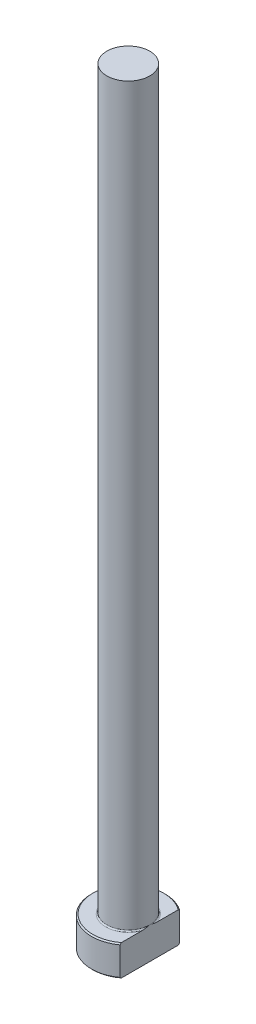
SolidWorks part; units mm, degrees
ref_plane "Front Plane" through (0, 0, 0) normal (0, 0, 1) x (1, 0, 0)
ref_plane "Top Plane" through (0, 0, 0) normal (0, 1, 0) x (1, 0, 0)
ref_plane "Right Plane" through (0, 0, 0) normal (1, 0, 0) x (0, 0, -1)
sketch "Sketch1" plane through (0, 0, 0) normal (0, 0, 1) x (1, 0, 0)
  line L0 (0, 259.9588) -> (0, -15.1925) construction
  line L1 (0, 0) -> (-6, 0)
  line L2 (-6, 0) -> (-6, 5)
  line L3 (-6, 5) -> (-3.5, 5)
  line L4 (-3.5, 5) -> (-3.5, 125)
  line L5 (-3.5, 125) -> (0, 125)
  line L6 (0, 125) -> (0, 0)
  dimension "L" = 125
  dimension "H" = 12
  dimension "T" = 5
  dimension "D" = 7
revolve "Revolve1" add sketch "Sketch1" angle 360 about L0
chamfer "Chamfer1" distance 0.2 angle 45 2 edges at (0, 5, 6) (0, 0, 6)
fillet "Fillet1" radius 0.2 1 edges at (0, 5, 3.5)
sketch "Sketch2" plane through (0, 0, 0) normal (0, 1, 0) x (1, 0, 0)
  line L0 (3.5, 4.8734) -> (3.5, -4.8734)
  circle A0 centre (0, 0) radius 6 construction
  arc A1 (3.5, -4.8734) -> (3.5, 4.8734) centre (0, 0) ccw
  circle A2 centre (0, 0) radius 3.5 construction
extrude "KEY" cut sketch "Sketch2" along normal through all
